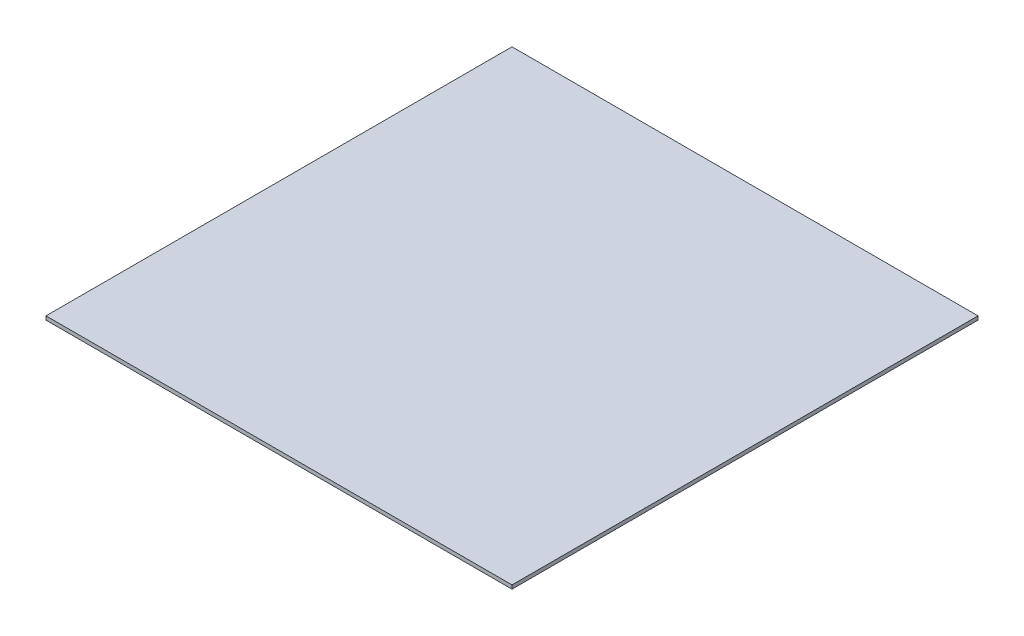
SolidWorks part; units mm, degrees
ref_plane "Front Plane" through (0, 0, 0) normal (0, 0, 1) x (1, 0, 0)
ref_plane "Top Plane" through (0, 0, 0) normal (0, 1, 0) x (1, 0, 0)
ref_plane "Right Plane" through (0, 0, 0) normal (1, 0, 0) x (0, 0, -1)
sketch "Sketch1" plane through (0, 0, 0) normal (0, 1, 0) x (1, 0, 0)
  line L1 (-250, -250) -> (250, -250)
  line L2 (-250, -250) -> (-250, 250)
  line L3 (-250, 250) -> (250, 250)
  line L4 (250, -250) -> (250, 250)
  line L5 (-250, -250) -> (250, 250) construction
  line L6 (-250, 250) -> (250, -250) construction
  point P0 (0, 0)
  dimension "D1" = 500
  dimension "D2" = 500
extrude "Boss-Extrude1" add sketch "Sketch1" along normal blind 4
